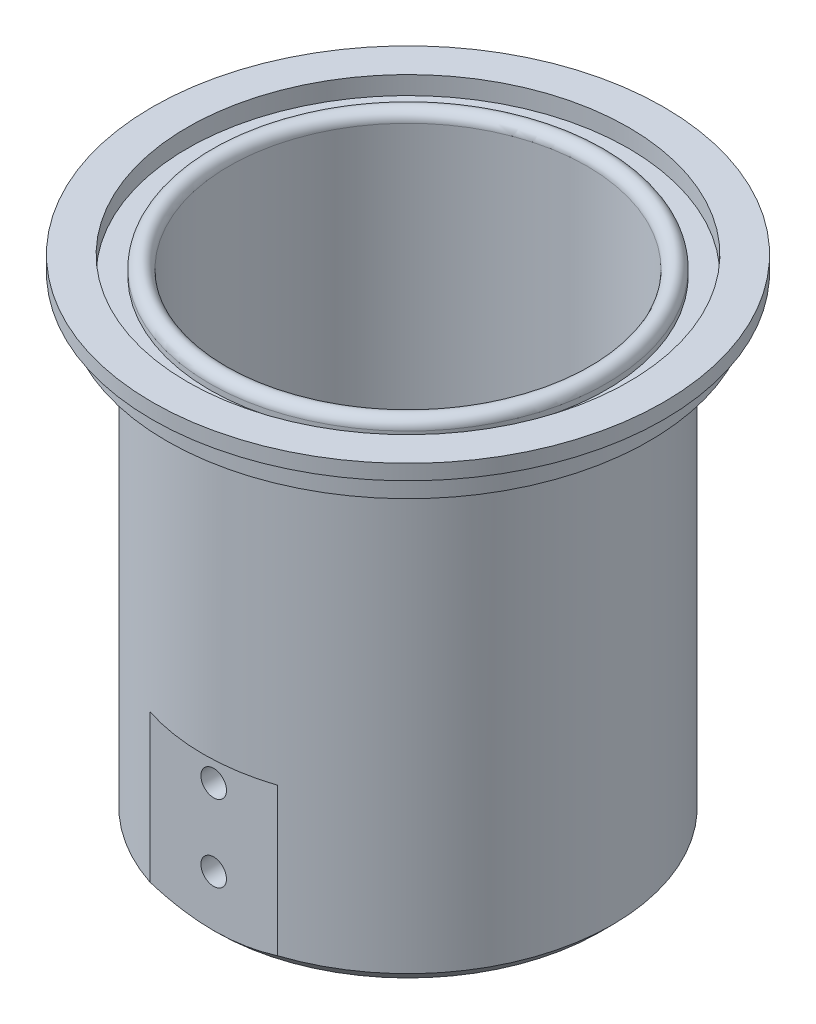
SolidWorks part; units mm, degrees
ref_plane "FRONT" through (0, 0, 0) normal (0, 0, 1) x (1, 0, 0)
ref_plane "TOP" through (0, 0, 0) normal (0, 1, 0) x (1, 0, 0)
ref_plane "RT-SIDE" through (0, 0, 0) normal (1, 0, 0) x (0, 0, -1)
sketch "Sketch1" plane through (0, 0, 0) normal (0, 0, 1) x (1, 0, 0)
  line L0 (0, 0) -> (0, -97.6878) construction
  line L1 (0, -115.57) -> (44.45, -115.57)
  line L2 (44.45, -115.57) -> (44.45, -3.1687)
  line L3 (54.7751, 0) -> (44.45, 0)
  line L4 (50.8, -121.92) -> (44.45, -121.92)
  line L5 (44.45, -121.92) -> (19.05, -134.62)
  line L6 (19.05, -134.62) -> (0, -134.62)
  line L7 (54.7751, 0) -> (63.5, 0)
  line L8 (63.5, 0) -> (63.5, -3.7592)
  line L9 (63.5, -3.7592) -> (59.9186, -5.0627)
  line L10 (59.9186, -5.0627) -> (59.9186, -10.1427)
  line L11 (59.9186, -10.1427) -> (50.8, -13.4616)
  line L12 (50.8, -13.4616) -> (50.8, -121.92)
  line L13 (0, -115.57) -> (0, -134.62)
  line L15 (44.45, 0) -> (44.45, -3.1687)
  dimension "D1" = 6.35
  dimension "D2" = 19.05
  dimension "D3" = 19.05
  dimension "D4" = 44.45
  dimension "D5" = 6.35
  dimension "D7" = 6.35
  dimension "D8" = 63.5
  dimension "D9" = 3.7592
  dimension "D10" = 250
  dimension "D11" = 3.5814
  dimension "D12" = 250
  dimension "D13" = 115.57
  dimension "D15" = 5.08
revolve "Base-Revolve" add sketch "Sketch1" angle 360 about L0
sketch "Sketch4" plane through (0, 0, 0) normal (0, 0, 1) x (1, 0, 0)
  line L0 (-44.45, -3.175) -> (0, -3.1747)
  line L2 (-49.2125, -3.1686) -> (-49.2125, -4.5212)
  line L3 (-49.2125, -4.5212) -> (-54.7751, -4.5212)
  line L4 (-54.7751, -4.5212) -> (-54.7751, 0)
  line L6 (0, -0.0219) -> (0, -46.3872) construction
  line L8 (-54.7751, 0) -> (0, -0.0219)
  line L11 (0, -3.1747) -> (0, -0.0219)
  line L12 (-44.45, 0) -> (-44.45, -115.57) construction
  arc A0 (-44.45, -3.175) -> (-49.2125, -3.1686) centre (-46.8312, -3.1718) ccw
  dimension "D1" = 2.3813
  dimension "D2" = 3.1686
  dimension "D3" = 4.5212
  dimension "D4" = 5.5626
  dimension "D5" = 1.3525
revolve "Cut-Revolve1" cut sketch "Sketch4" angle 360 about L6
sketch "Sketch6" plane through (0, -134.62, 0) normal (0, -1, 0) x (1, 0, 0)
  circle A1 centre (31.75, 0) radius 6.35
  dimension "D1" = 31.75
  dimension "D2" = 12.7
extrude "Cut-Extrude1" cut sketch "Sketch6" against normal through all
pattern_circular "CirPattern1" count 6 over 360 about axis through (0, 0, 0) along (0, -1, 0)
sketch "Sketch7" plane through (0, -134.62, 0) normal (0, -1, 0) x (1, 0, 0)
  line L0 (-17.145, 9.672) -> (-17.145, -9.672)
  line L3 (0, 0) -> (81.756, 0) construction
  arc A0 (-17.145, -9.672) -> (-17.145, 9.672) centre (0, 0) ccw
  dimension "D1" = 39.37
  dimension "D2" = 17.145
extrude "Cut-Extrude2" cut sketch "Sketch7" against normal through all
sketch "Sketch10" plane through (0, -134.62, 0) normal (0, -1, 0) x (1, 0, 0)
  circle A0 centre (0, 0) radius 7.1142
  dimension "D1" = 14.2283
extrude "Cut-Extrude3" [suppressed] cut sketch "Sketch10" against normal through all
chamfer "Chamfer1" distance 3.175 angle 45
ref_plane "Plane1" through (0, -76.2, 0) normal (0, 1, 0) x (-1, 0, 0)
sketch "Sketch9" plane through (0, 0, 0) normal (0, 0, 1) x (1, 0, 0)
  line L0 (44.45, -76.2) -> (38.1, -76.2)
  line L1 (50, -76.2) -> (-50, -76.2) construction
  line L2 (38.1, -76.2) -> (38.1, -115.57)
  line L3 (38.1, -115.57) -> (25.4, -115.57) construction
  line L4 (38.1, -115.57) -> (44.45, -115.57)
  line L5 (44.45, -115.57) -> (-44.45, -115.57) construction
  line L6 (44.45, -115.57) -> (44.45, -76.2)
  line L7 (44.45, -115.57) -> (44.45, -3.175) construction
  line L8 (38.1, -125.095) -> (38.1, -115.57) construction
  line L9 (0, 0) -> (0, -46.8272) construction
  line L10 (0, -115.57) -> (0, -134.3025) construction
revolve "Boss-Revolve1" add sketch "Sketch9" angle 360 about L9
chamfer "Chamfer2" [suppressed] distance 1.524 angle 20
ref_plane "Plane2" through (0, 0, 50.8) normal (0, 0, 1) x (1, 0, 0)
sketch "Sketch11" plane through (0, 0, 50.8) normal (0, 0, 1) x (1, 0, 0)
  line L0 (50.8, -118.745) -> (-50.8, -118.745) construction
  line L1 (-15.875, -82.0759) -> (15.875, -82.0759)
  line L2 (-15.875, -82.0759) -> (-15.875, -135.8187)
  line L3 (-15.875, -135.8187) -> (15.875, -135.8187)
  line L4 (15.875, -82.0759) -> (15.875, -135.8187)
  line L5 (0, 0) -> (0, -95.6595) construction
  line L6 (0, -115.57) -> (0, -134.3025) construction
  dimension "D1" = 31.75
  dimension "D2" = 36.6691
extrude "Cut-Extrude4" cut sketch "Sketch11" against normal blind 2.54
pattern_circular "CirPattern2" count 2 over 360 about axis through (0, 0, 0) along (0, -1, 0)
sketch "Sketch12" plane through (0, 0, -48.26) normal (0, 0, -1) x (-1, 0, 0)
  line L0 (0, 0) -> (0, -56.1026) construction
  line L1 (0, -118.745) -> (0, -121.92) construction
  line L2 (-50.8, -118.745) -> (-15.8623, -118.745) construction
  circle A0 centre (0, -89.535) radius 3.175
  circle A1 centre (0, -108.585) radius 3.175
  dimension "D1" = 6.35
  dimension "D2" = 6.35
  dimension "D3" = 19.05
  dimension "D4" = 10.16
extrude "Cut-Extrude5" cut sketch "Sketch12" against normal through all
